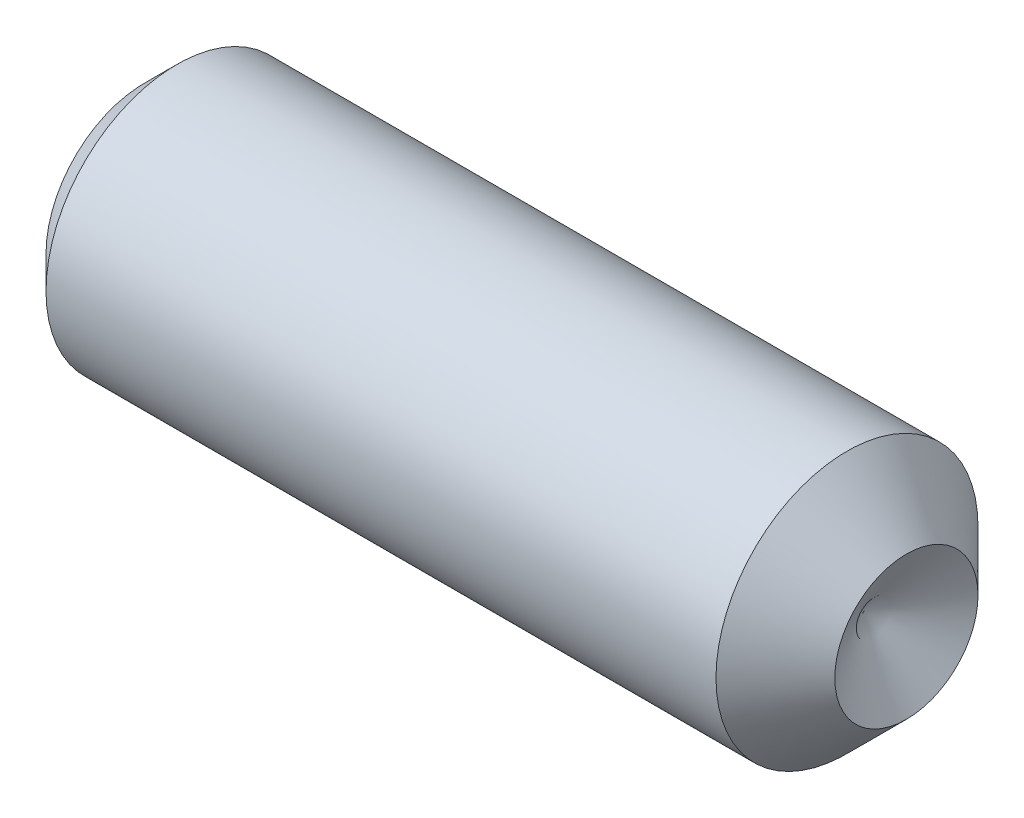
SolidWorks part; units mm, degrees
ref_plane "Plane1" through (0, 0, 0) normal (0, 0, 1) x (1, 0, 0)
ref_plane "Plane2" through (0, 0, 0) normal (0, 1, 0) x (1, 0, 0)
ref_plane "Plane3" through (0, 0, 0) normal (1, 0, 0) x (0, 0, -1)
revolve "BaseBody" add sketch "BodySke" angle 360 about L5
sketch "BodySke" plane through (0, 0, 0) normal (0, 0, 1) x (1, 0, 0)
  line L0 (0, 0) -> (0, 0.823)
  line L1 (0, 0.823) -> (0.2692, 1.0922)
  line L2 (0.2692, 1.0922) -> (5.8547, 1.0922)
  line L3 (5.8547, 1.0922) -> (6.35, 0.5969)
  line L4 (5.9913, 0) -> (0, 0)
  line L5 (-12.7, 0) -> (88.9, 0) construction
  line L6 (5.9913, 0) -> (6.35, 0.5969)
  line L7 (6.35, 0.5969) -> (6.35, 10.1219) construction
  line L8 (0, -0.823) -> (0.2692, -1.0922) construction
  line L9 (5.9913, 0) -> (6.35, -0.5969) construction
  line L10 (5.8547, -1.0922) -> (6.35, -0.5969) construction
  line L11 (0.4547, 15.875) -> (0.4547, -3.175) construction
  dimension "Length" = 6.35
  dimension "Diameter" = 2.1844
  dimension "Drive_ch_ang" = 45
  dimension "Minor_dia" = 1.6459
  dimension "Cup_nose_ang" = 45
  dimension "Cup_ang" = 118
  dimension "Cup_dia" = 1.1938
  dimension "Advance" = 0.4547
sketch "Sketch2" plane through (0, 0, 0) normal (-1, 0, 0) x (0, 0, 1)
  line L0 (0.2566, 0.4445) -> (-0.2566, 0.4445)
  line L1 (-0.2566, 0.4445) -> (-0.5133, 0)
  line L2 (0.2566, 0.4445) -> (0.5133, 0)
  line L3 (0.2566, -0.4445) -> (0.5133, 0)
  line L4 (0.2566, -0.4445) -> (-0.2566, -0.4445)
  line L5 (-0.2566, -0.4445) -> (-0.5133, 0)
  dimension "Hex_size" = 0.889
  dimension "D2" = 0.4445
  dimension "D3" = 0.4445
extrude "Hex" cut sketch "Sketch2" against normal blind 1.524
sketch "Sketch4" plane through (0, 4.7709, -0.5249) normal (-1, 0, 0) x (0, 0, 1)
  line L0 (0.5249, -4.7709) -> (1.1599, -4.7709)
  line L1 (0.5249, -4.7709) -> (6.6732, -1.2211) construction
  line L2 (0.5249, -4.7709) -> (0.8424, -4.2209)
  line L3 (1.0291, -4.6411) -> (1.1312, -4.5821)
  line L4 (0.8894, -4.3991) -> (0.9915, -4.3402)
  arc A0 (1.0291, -4.6411) -> (0.8894, -4.3991) centre (0.5249, -4.7709) ccw
  arc A1 (1.1599, -4.7709) -> (1.1312, -4.5821) centre (0.5249, -4.7709) ccw
  arc A2 (0.8424, -4.2209) -> (0.9915, -4.3402) centre (0.5249, -4.7709) cw
  circle A3 centre (0.5249, -4.7709) radius 0.5207 construction
  circle A4 centre (0.5249, -4.7709) radius 0.635 construction
  dimension "D1" = 30
  dimension "Spline_n_dim" = 1.0414
  dimension "Spline_m_dim" = 1.27
  dimension "Spline_a_dim" = 60
  dimension "D3" = 0.1397
  dimension "Spline_p_dim" = 0.2794
extrude "Spline" [suppressed] cut sketch "Sketch4" against normal blind 1.016
pattern_circular "CirPattern1" [suppressed] count 6 every 60 about axis through (-12.7, 0, 0) along (1, 0, 0)
sketch "ThdSchSke" plane through (0, 0, 0) normal (0, 0, 1) x (1, 0, 0)
  line L0 (0.2692, -0.823) -> (0.0807, -1.0922)
  line L1 (0.2692, -0.823) -> (0.4578, -1.0922)
  line L2 (0.4578, -1.0922) -> (0.4578, -1.3653)
  line L3 (-3.175, 0) -> (5.1513, 0) construction
  line L4 (0.2692, 1.0922) -> (0.2692, -1.0922) construction
  line L5 (0.4578, -1.3653) -> (0.0807, -1.3653)
  line L6 (0.0807, -1.3653) -> (0.0807, -1.0922)
  dimension "Thread_minor" = 1.6459
  dimension "Diameter" = 2.1844
  dimension "SideAngle" = 55
  dimension "VeeAngle" = 70
  dimension "Overcut" = 2.7305
revolve "ThreadSchematic" [suppressed] cut sketch "ThdSchSke" angle 360 about L3
pattern_linear "ThdSchPat" [suppressed]
equation "\"D2@Sketch2\" = \"Hex_size@Sketch2\" / 2"
equation "\"D3@Sketch2\" = \"Hex_size@Sketch2\" / 2"
equation "\"Thread_minor@ThreadCosmetic\" = \"Minor_dia@BodySke\""
equation "\"D1@Sketch4\" = \"Spline_a_dim@Sketch4\" / 2"
equation "\"D3@Sketch4\" = \"Spline_p_dim@Sketch4\" / 2"
equation "\"D2@CirPattern1\" = \"Spline_a_dim@Sketch4\""
equation "\"Num_teeth@CirPattern1\" = 360 / \"D2@CirPattern1\""
equation "\"Thread_minor@ThdSchSke\" = \"Thread_minor@ThreadCosmetic\""
equation "\"Diameter@ThdSchSke\" = \"Diameter@BodySke\""
equation "\"Overcut@ThdSchSke\" = \"Diameter@BodySke\" * 1.25"
equation "\"Num_threads@ThdSchPat\" = int( (\"Length@BodySke\" - ( ( ( \"Diameter@BodySke\" - \"Minor_dia@BodySke\" ) * 0.5 ) / tan( \"Drive_ch_ang@BodySke\" * 0.017453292 ) ) - ( ( ( \"Diameter@BodySke\" - \"Cup_dia@BodySk"
equation "\"Advance@ThdSchPat\" = (\"Length@BodySke\" - ( ( ( \"Diameter@BodySke\" - \"Minor_dia@BodySke\" ) * 0.5 ) / tan( \"Drive_ch_ang@BodySke\" * 0.017453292 ) ) - ( ( ( \"Diameter@BodySke\" - \"Cup_dia@BodySke\" ) * 0."
equation "' \"Num_threads@ThdSchPat\" = \"Num_threads@ThdSchPat\" - sgn( \"Num_threads@ThdSchPat\" - 1) '---chamfered tips only---"
